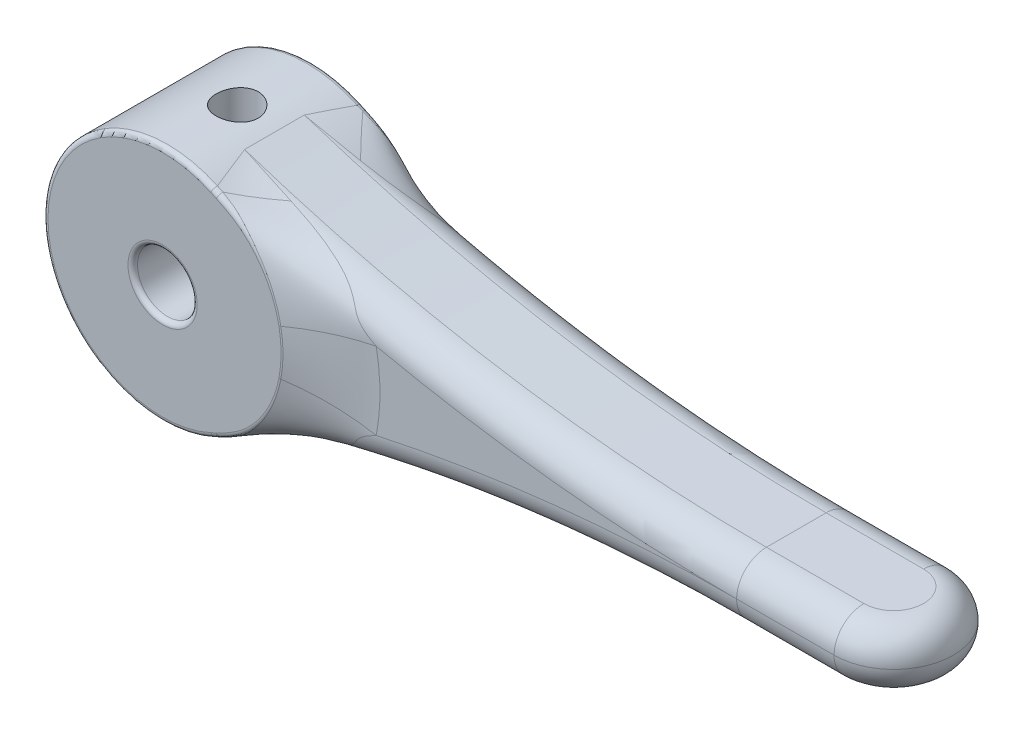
SolidWorks part; units mm, degrees
ref_plane "Front" through (0, 0, 0) normal (0, 0, 1) x (1, 0, 0)
ref_plane "Top" through (0, 0, 0) normal (0, 1, 0) x (1, 0, 0)
ref_plane "Right" through (0, 0, 0) normal (1, 0, 0) x (0, 0, -1)
sketch "Sketch1" plane through (0, 0, 0) normal (0, 0, 1) x (1, 0, 0)
  circle A0 centre (0, 0) radius 6.35
  dimension "D1" = 12.7
extrude "Base-Extrude" add sketch "Sketch1" along normal mid plane 7.9375
sketch "Sketch3" plane through (0, 0, 0) normal (0, 1, 0) x (1, 0, 0)
  line L0 (0, 3.175) -> (34.925, 3.175)
  line L1 (0, 3.175) -> (0, -3.175)
  line L2 (34.925, -3.175) -> (0, -3.175)
  line L4 (0, -3.9688) -> (0, 3.9688) construction
  line L5 (-8.8894, 0) -> (29.3148, 0) construction
  line L6 (-50, 0) -> (50, 0) construction
  arc A0 (34.925, 3.175) -> (34.925, -3.175) centre (34.925, 0) cw
  dimension "D1" = 3.175
  dimension "D2" = 38.1
extrude "Boss-Extrude1" add sketch "Sketch3" along normal mid plane 3.175
fillet "Fillet1" radius 88.9 2 edges at (6.1484, -1.5875, 0) (6.1484, 1.5875, 0)
fillet "Fillet6" radius 1.5875 12 edges at (32.3334, 1.5875, -3.175) (32.3334, -1.5875, -3.175) (15.6855, 2.7058, 3.175) (15.6855, 2.7058, -3.175) (15.6855, -2.7058, 3.175) (15.6855, -2.7058, -3.175) (32.3334, 1.5875, 3.175) (34.925, 0, -3.175) (38.1, -1.5875, 0) (32.3334, -1.5875, 3.175) (38.1, 1.5875, 0) (34.925, 0, 3.175)
fillet "Fillet7" radius 12.7 6 edges at (6.35, 0, -3.175) (6.35, 0, 3.175) (4.6962, 4.2741, -3.0075) (4.6962, -4.2741, -3.0075) (4.6962, 4.2741, 3.0075) (4.6962, -4.2741, 3.0075)
other "Hole1"
sketch "Sketch4" plane through (0, 0, 3.9688) normal (0, 0, 1) x (1, 0, 0)
  circle A0 centre (0, 0) radius 1.5875
  arc A1 (2.7465, 5.7253) -> (2.7465, -5.7253) centre (0, 0) ccw construction
  dimension "D1" = 3.175
sketch "Sketch5" plane through (0, 0, 0) normal (0, 1, 0) x (1, 0, 0)
  line L0 (0, -3.9688) -> (0, 3.9688) construction
  line L2 (0, -50) -> (0, 50) construction
  line L4 (-50, 0) -> (50, 0) construction
  circle A0 centre (0, 0) radius 1.1187
  dimension "D1" = 2.2374
extrude "Cut-Extrude1" cut sketch "Sketch5" against normal through all and the other way through all
fillet "Fillet12" radius 0.254 12 edges at (1.5875, 0, -3.9688) (1.5875, 0, 3.9688) (5.0254, 3.8817, -3.9688) (5.0254, 3.8817, 3.9688) (-6.35, 0, -3.9688) (5.0254, -3.8817, -3.9688) (6.35, 0, -3.9688) (-6.35, 0, 3.9688) (5.0254, -3.8817, 3.9688) (6.35, 0, 3.9688)
